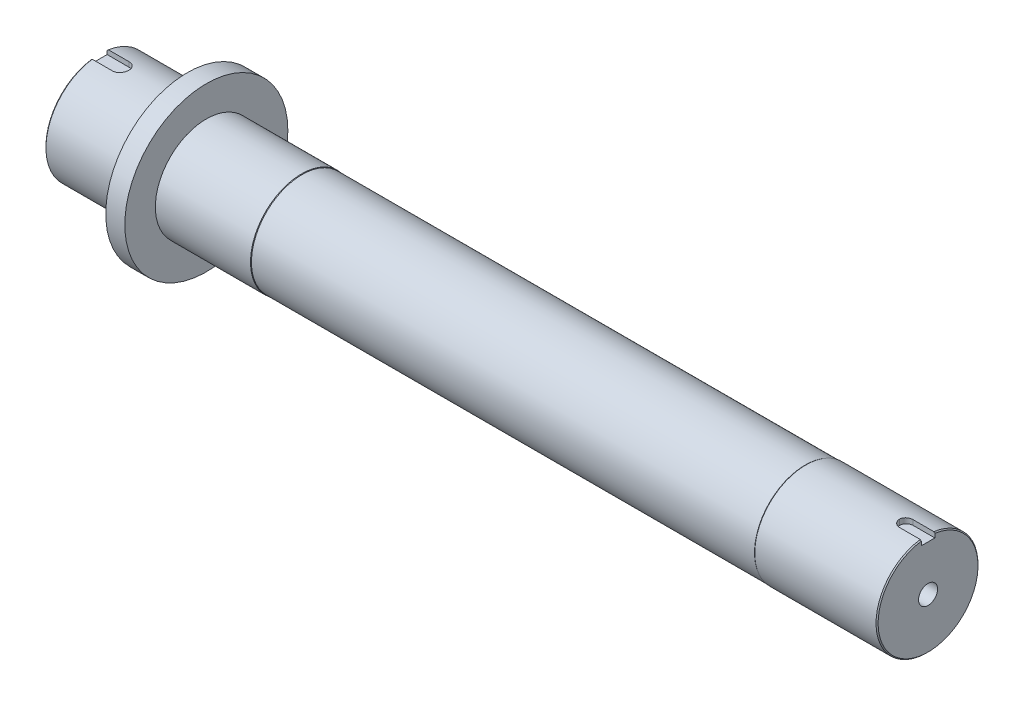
SolidWorks part; units mm, degrees
ref_plane "Face" through (0, 0, 0) normal (0, 0, 1) x (1, 0, 0)
ref_plane "Dessus" through (0, 0, 0) normal (0, 1, 0) x (1, 0, 0)
ref_plane "Droite" through (0, 0, 0) normal (1, 0, 0) x (0, 0, -1)
sketch "Esquisse1" plane through (0, 0, 0) normal (0, 0, 1) x (1, 0, 0)
  line L0 (0, 0) -> (-70.9711, 0) construction
  line L1 (0, 40) -> (0, 0)
  line L2 (65, 60) -> (79, 60)
  line L3 (79, 60) -> (79, 37.5)
  line L4 (65, 60) -> (65, 40)
  line L5 (65, 40) -> (0, 40)
  line L6 (79, 37.5) -> (149, 37.5)
  line L7 (610, 37.5) -> (610, 0)
  line L8 (0, 0) -> (610, 0)
  line L9 (149, 37.5) -> (149.433, 37.25)
  line L10 (149.433, 37.25) -> (519.567, 37.25)
  line L11 (519.567, 37.25) -> (520, 37.5)
  line L12 (520, 37.5) -> (610, 37.5)
  dimension "D2" = 70
  dimension "D3" = 120
  dimension "D4" = 75
  dimension "D5" = 80
  dimension "D6" = 65
  dimension "D7" = 14
  dimension "D8" = 90
  dimension "D9" = 0.25
  dimension "D10" = 30
  dimension "D11" = 30
  dimension "D12" = 531
  dimension "D13" = 75
revolve "Révolution1" add sketch "Esquisse1" angle 360 about L0
sketch "Esquisse2" plane through (610, 0, 0) normal (1, 0, 0) x (0, 0, -1)
  line L0 (0, 0) -> (0, 68.5043) construction
  line L1 (-5, 37.5) -> (5, 37.5)
  line L2 (-5, 37.5) -> (-5, 33.5)
  line L3 (-5, 33.5) -> (5, 33.5)
  line L4 (5, 37.5) -> (5, 33.5)
  circle A0 centre (0, 0) radius 37.5 construction
  circle A1 centre (0, 0) radius 37.5 construction
  dimension "D1" = 71
  dimension "D2" = 10
extrude "Enlèv. mat.-Extru.1" cut sketch "Esquisse2" against normal blind 21
fillet "Congé1" radius 5 2 edges at (589, 35.3326, 5) (589, 35.3326, -5)
sketch "Esquisse4" plane through (0, 0, 0) normal (-1, 0, 0) x (0, 0, 1)
  line L0 (0, 0) -> (0, 81.505) construction
  line L1 (-6, 40) -> (6, 40)
  line L2 (-6, 40) -> (-6, 36)
  line L3 (-6, 36) -> (6, 36)
  line L4 (6, 40) -> (6, 36)
  circle A0 centre (0, 0) radius 40 construction
  dimension "D1" = 12
  dimension "D4" = 76
extrude "Enlèv. mat.-Extru.2" cut sketch "Esquisse4" against normal blind 22
fillet "Congé2" radius 6 2 edges at (22, 37.7737, -6) (22, 37.7737, 6)
sketch "Esquisse5" plane through (79, 0, 0) normal (1, 0, 0) x (0, 0, -1)
  line L1 (40, 50) -> (60, 50)
  line L2 (40, 50) -> (40, -50)
  line L3 (40, -50) -> (60, -50)
  line L4 (60, 50) -> (60, -50)
  line L5 (-60, 50) -> (-40, 50)
  line L6 (-60, 50) -> (-60, -50)
  line L7 (-60, -50) -> (-40, -50)
  line L8 (-40, 50) -> (-40, -50)
  dimension "D1" = 20
  dimension "D2" = 20
  dimension "D3" = 40
  dimension "D4" = 40
  dimension "D5" = 100
  dimension "D6" = 50
extrude "Enlèv. mat.-Extru.3" cut sketch "Esquisse5" against normal blind 12
chamfer "Chanfrein1" distance 0.75 angle 45 1 edges at (610, -37.5, 0)
chamfer "Chanfrein2" distance 1 angle 45 1 edges at (0, -40, 0)
hole_wizard "Trou taraudé M161" positions "Esquisse7" profile "Esquisse6" tap size "M16" standard "ISO"
sketch "Esquisse7" plane through (610, 0, 0) normal (1, 0, 0) x (0, 0, -1)
  point P0 (0, 0)
sketch "Esquisse6" plane through (610, 0, 0) normal (0, 1, 0) x (0, 0, -1)
  line L0 (0, 0) -> (0, 34.0415)
  line L1 (0, 34.0415) -> (7, 30)
  line L2 (7, 30) -> (7, 0)
  line L5 (7, 0) -> (0, 0)
  line L10 (0, 34.0415) -> (-7, 30) construction
  line L11 (0, -6.35) -> (0, 107.95) construction
  dimension "Diamètre du trou pour taraudage" = 14
  dimension "Profondeur du trou pour taraudage" = 30
  dimension "Angle de pointe" = 120
